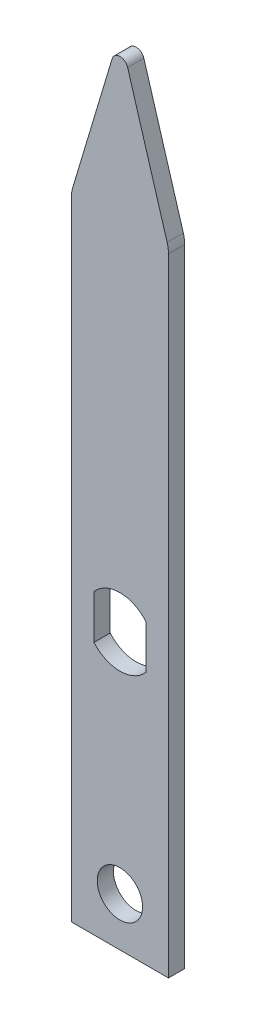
SolidWorks part; units mm, degrees
ref_plane "Plan de face" through (0, 0, 0) normal (0, 0, 1) x (1, 0, 0)
ref_plane "Plan de dessus" through (0, 0, 0) normal (0, 1, 0) x (1, 0, 0)
ref_plane "Plan de droite" through (0, 0, 0) normal (1, 0, 0) x (0, 0, -1)
sketch "Esquisse1" plane through (0, 0, 0) normal (0, 0, 1) x (1, 0, 0)
  line L0 (-15, 0) -> (-15, 195)
  line L1 (-15, 195) -> (0, 245)
  line L2 (0, 245) -> (15, 195)
  line L3 (15, 195) -> (15, 0)
  line L4 (15, 0) -> (-15, 0)
  point P2 (0, 0)
  dimension "D1" = 30
  dimension "D2" = 245
  dimension "D3" = 195
extrude "Extrusion1" add sketch "Esquisse1" along normal blind 5
sketch "Esquisse2" plane through (0, 0, 5) normal (0, 0, 1) x (1, 0, 0)
  line L0 (-15, 0) -> (15, 0) construction
  circle A0 centre (0, 15) radius 7
  dimension "D1" = 14
  dimension "D2" = 15
extrude "Extrusion2" cut sketch "Esquisse2" against normal up to next
sketch "Esquisse3" plane through (0, 0, 5) normal (0, 0, 1) x (1, 0, 0)
  line L0 (-8, 91.8007) -> (-8, 78.1993)
  line L1 (8, 91.8007) -> (8, 78.1993)
  arc A0 (8, 91.8007) -> (-8, 91.8007) centre (0, 85) ccw
  arc A1 (-8, 78.1993) -> (8, 78.1993) centre (0, 85) ccw
  circle A2 centre (0, 15) radius 7 construction
  dimension "D1" = 70
  dimension "D2" = 10.5
  dimension "D3" = 16
extrude "Extrusion3" cut sketch "Esquisse3" against normal up to next
fillet "Congé2" radius 2.5 1 edges at (0, 245, 2.5)
fillet "Congé3" radius 10 2 edges at (15, 195, 2.5) (-15, 195, 2.5)
